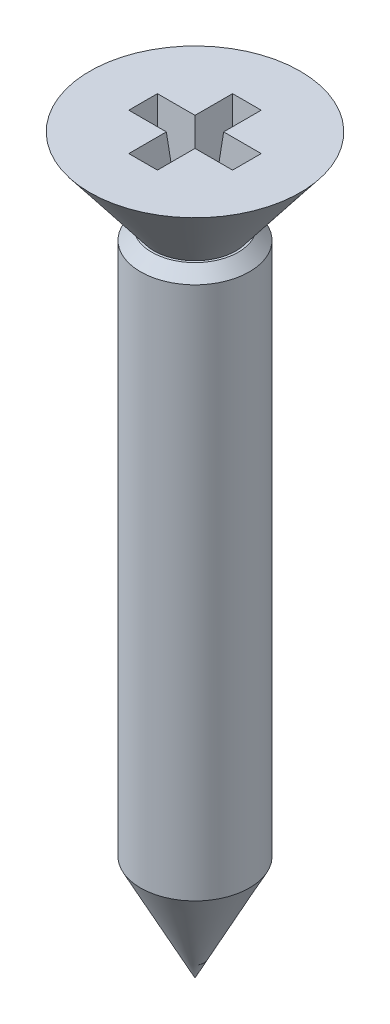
SolidWorks part; units mm, degrees
ref_plane "Face" through (0, 0, 0) normal (0, 0, 1) x (1, 0, 0)
ref_plane "Dessus" through (0, 0, 0) normal (0, 1, 0) x (1, 0, 0)
ref_plane "Droite" through (0, 0, 0) normal (1, 0, 0) x (0, 0, -1)
sketch "Esquisse1" plane through (0, 0, 0) normal (0, 0, 1) x (1, 0, 0)
  line L0 (0, 0) -> (0, -19.0471) construction
  line L1 (0, -3.4482) -> (2.8, -3.4482)
  line L2 (1.45, -5.6482) -> (1.45, -20.1482)
  line L3 (1.09, -5.6482) -> (2.8, -3.4482)
  line L5 (1.09, -5.6482) -> (1.45, -5.6482)
  line L7 (1.45, -20.1482) -> (0, -22.9482)
  line L8 (0, -3.4482) -> (0, -22.9482)
  dimension "D2" = 2.8
  dimension "D3" = 2.7864
  dimension "D4" = 0.36
  dimension "D5" = 3.1532
  dimension "D6" = 19.5
revolve "Révolution1" add sketch "Esquisse1" angle 360 about L0
chamfer "Chanfrein2" distance 0.3 angle 45 1 edges at (0, -5.6482, 1.45)
sketch "Esquisse2" plane through (0, -3.4482, 0) normal (0, 1, 0) x (-1, 0, 0)
  line L0 (0, 3.144) -> (0, -3.0562) construction
  line L1 (3.2044, 0) -> (-3.2702, 0) construction
  line L2 (0.25, -1.25) -> (-0.25, -1.25)
  line L3 (-0.25, -1.25) -> (-0.25, -0.25)
  line L4 (-1.25, -0.25) -> (-1.25, 0.25)
  line L5 (-1.25, 0.25) -> (-0.25, 0.25)
  line L6 (-0.25, 0.25) -> (-0.25, 1.25)
  line L7 (-0.25, 1.25) -> (0.25, 1.25)
  line L8 (0.25, 1.25) -> (0.25, 0.25)
  line L9 (0.25, 0.25) -> (1.25, 0.25)
  line L10 (1.25, 0.25) -> (1.25, -0.25)
  line L11 (1.25, -0.25) -> (0.25, -0.25)
  line L12 (0.25, -0.25) -> (0.25, -1.25)
  line L13 (-0.25, -0.25) -> (-1.25, -0.25)
  dimension "D1" = 0.5
  dimension "D2" = 0.5
  dimension "D3" = 0.5
  dimension "D4" = 1
  dimension "D5" = 1
extrude "Enlèv. mat.-Extru.1" cut sketch "Esquisse2" against normal blind 1.5
draft "Dépouille1" type of draft neutral plane draft angle 5 faces to draft 12 parameters "D1"=5
